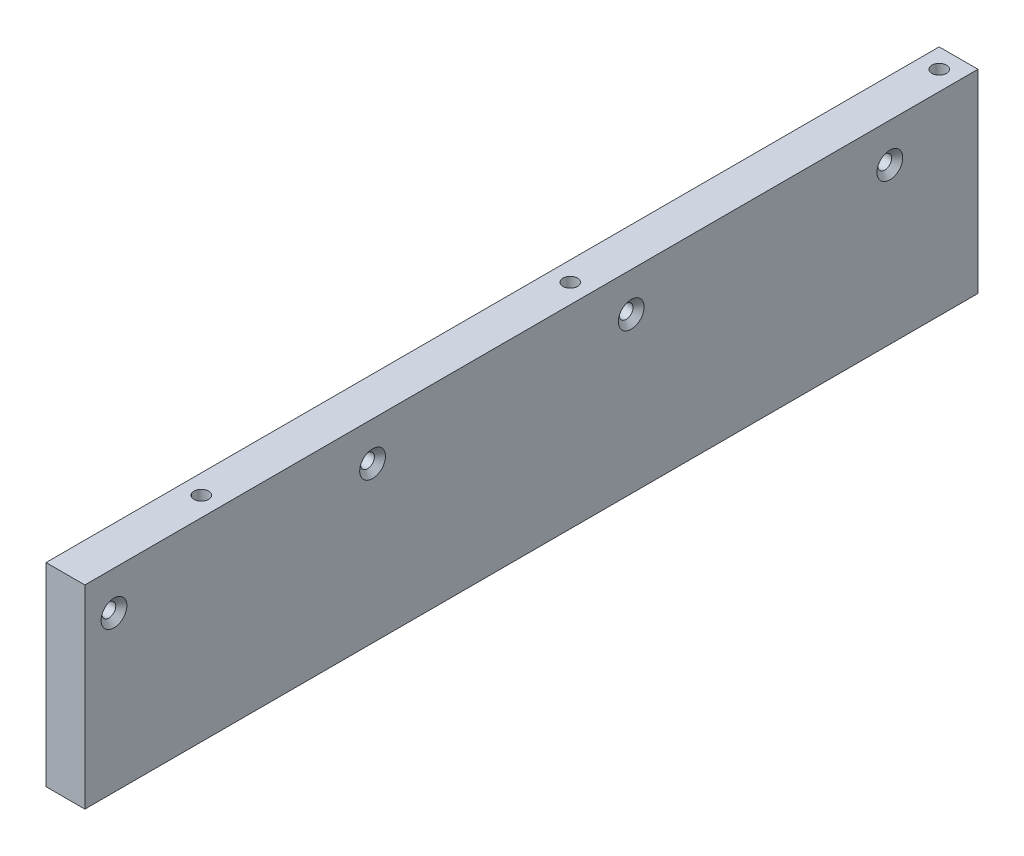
SolidWorks part; units mm, degrees
ref_plane "Front Plane" through (0, 0, 0) normal (0, 0, 1) x (1, 0, 0)
ref_plane "Top Plane" through (0, 0, 0) normal (0, 1, 0) x (1, 0, 0)
ref_plane "Right Plane" through (0, 0, 0) normal (1, 0, 0) x (0, 0, -1)
sketch "Sketch3" plane through (0, 0, 0) normal (0, 1, 0) x (-1, 0, 0)
  line L1 (-68.2625, 133.35) -> (-55.5625, 133.35)
  line L2 (-68.2625, 133.35) -> (-68.2625, -158.75)
  line L3 (-68.2625, -158.75) -> (-55.5625, -158.75)
  line L4 (-55.5625, 133.35) -> (-55.5625, -158.75)
  dimension "D1" = 12.7
  dimension "D2" = 292.1
  dimension "D3" = 133.35
  dimension "D4" = 55.5625
extrude "Extrude3" add sketch "Sketch3" along normal blind 63.5
sketch "Sketch4" plane through (68.2625, 0, 0) normal (1, 0, 0) x (0, 0, -1)
  line L0 (-133.35, 63.5) -> (158.75, 63.5) construction
  line L2 (-133.35, 63.5) -> (-133.35, 0) construction
  circle A0 centre (-123.825, 50.8) radius 3.302
  circle A1 centre (-39.243, 50.8) radius 3.302
  circle A2 centre (45.339, 50.8) radius 3.302
  circle A3 centre (129.921, 50.8) radius 3.302
  dimension "D1" = 12.7
  dimension "D2" = 9.525
  dimension "D3" = 84.582
  dimension "D4" = 84.582
  dimension "D5" = 84.582
  dimension "D6" = 6.604
ref_plane "Plane1" through (0, 0, 0) normal (0, 1, 0) x (-1, 0, 0)
ref_plane "Plane2" through (0, 0, 0) normal (1, 0, 0) x (0, 0, -1)
sketch "Sketch5" plane through (0, 0, 0) normal (0, -1, 0) x (1, 0, 0)
  line L0 (55.5625, -158.75) -> (55.5625, 133.35) construction
  line L2 (68.2625, -158.75) -> (55.5625, -158.75) construction
  point P0 (61.9125, 88.9)
  point P1 (61.9125, -31.75)
  point P2 (61.9125, -152.4)
  dimension "D1" = 6.35
  dimension "D2" = 120.65
  dimension "D3" = 120.65
  dimension "D4" = 6.35
hole_wizard "#4 Clearance Hole1" positions "3DSketch1" profile "Sketch6" hole size "#4" standard "Ansi Inch"
sketch3d "3DSketch1"
  point P0 (61.9125, 0, 88.9)
  point P3 (61.9125, 0, -31.75)
  point P6 (61.9125, 0, -152.4)
sketch "Sketch6" plane through (61.9125, 0, 88.9) normal (1, 0, 0) x (0, 0, -1)
  line L0 (0, 0) -> (0, 83.5306)
  line L1 (0, 83.5306) -> (1.6319, 82.55)
  line L2 (1.6319, 82.55) -> (1.6319, 0)
  line L5 (1.6319, 0) -> (0, 0)
  line L10 (0, 83.5306) -> (-1.632, 82.55) construction
  line L11 (0, -6.35) -> (0, 107.95) construction
  dimension "Hole Dia." = 3.2639
  dimension "Hole Depth" = 82.55
  dimension "Drill Angle" = 118
hole_wizard "CSK for #8 Flat Head Machine Screw (100)2" positions "3DSketch2" profile "Sketch7" countersink size "#8" standard "Ansi Inch"
sketch3d "3DSketch2"
  point P0 (68.2625, 50.8, 123.825)
  point P8 (68.2625, 50.8, -45.339)
  point P17 (68.2625, 50.8, -129.921)
  point P20 (68.2625, 50.8, 39.243)
sketch "Sketch7" plane through (68.2625, 50.8, 123.825) normal (0, 1, 0) x (0, 0, -1)
  line L0 (0, 0) -> (0, 12.7)
  line L1 (0, 12.7) -> (2.2479, 12.7)
  line L2 (2.2479, 12.7) -> (2.2479, 1.6518)
  line L3 (2.2479, 1.6518) -> (4.2164, 0)
  line L5 (4.2164, 0) -> (0, 0)
  line L6 (-2.2479, 1.6518) -> (-4.2164, 0) construction
  line L11 (0, -6.35) -> (0, 107.95) construction
  dimension "Thru Hole Dia." = 4.4958
  dimension "Thru Hole Depth" = 12.7
  dimension "Near C'Sink Dia." = 8.4328
  dimension "Near C'Sink Angle" = 100
sketch "Sketch10" [suppressed] plane through (55.5625, 0, 0) normal (-1, 0, 0) x (0, 0, 1)
  point P0 (-139.7, 12.7)
  point P1 (-55.118, 12.7)
  point P3 (29.464, 12.7)
  point P5 (114.046, 12.7)
hole_wizard "CSK for #8 Flat Head Machine Screw (100)5" positions "3DSketch5" profile "Sketch11" countersink size "#8" standard "Ansi Inch"
sketch3d "3DSketch5"
  point P0 (55.5625, 12.7, -139.7)
  point P3 (55.5625, 12.7, -55.118)
  point P6 (55.5625, 12.7, 29.464)
  point P9 (55.5625, 12.7, 114.046)
sketch "Sketch11" plane through (55.5625, 12.7, -139.7) normal (0, 1, 0) x (0, 0, 1)
  line L0 (0, 0) -> (0, 12.7)
  line L1 (0, 12.7) -> (2.2479, 12.7)
  line L2 (2.2479, 12.7) -> (2.2479, 1.6518)
  line L3 (2.2479, 1.6518) -> (4.2164, 0)
  line L5 (4.2164, 0) -> (0, 0)
  line L6 (-2.2479, 1.6518) -> (-4.2164, 0) construction
  line L11 (0, -6.35) -> (0, 107.95) construction
  dimension "Thru Hole Dia." = 4.4958
  dimension "Thru Hole Depth" = 12.7
  dimension "Near C'Sink Dia." = 8.4328
  dimension "Near C'Sink Angle" = 100
sketch "Sketch12" plane through (0, 63.5, 0) normal (0, 1, 0) x (1, 0, 0)
  circle A0 centre (61.9125, 152.4) radius 2.3749
extrude "Cut-Extrude1" cut sketch "Sketch12" against normal blind 50.8
pattern_linear "LPattern1" count 3 spacing 120.65 along (0, 0, 1) of "Cut-Extrude1"
